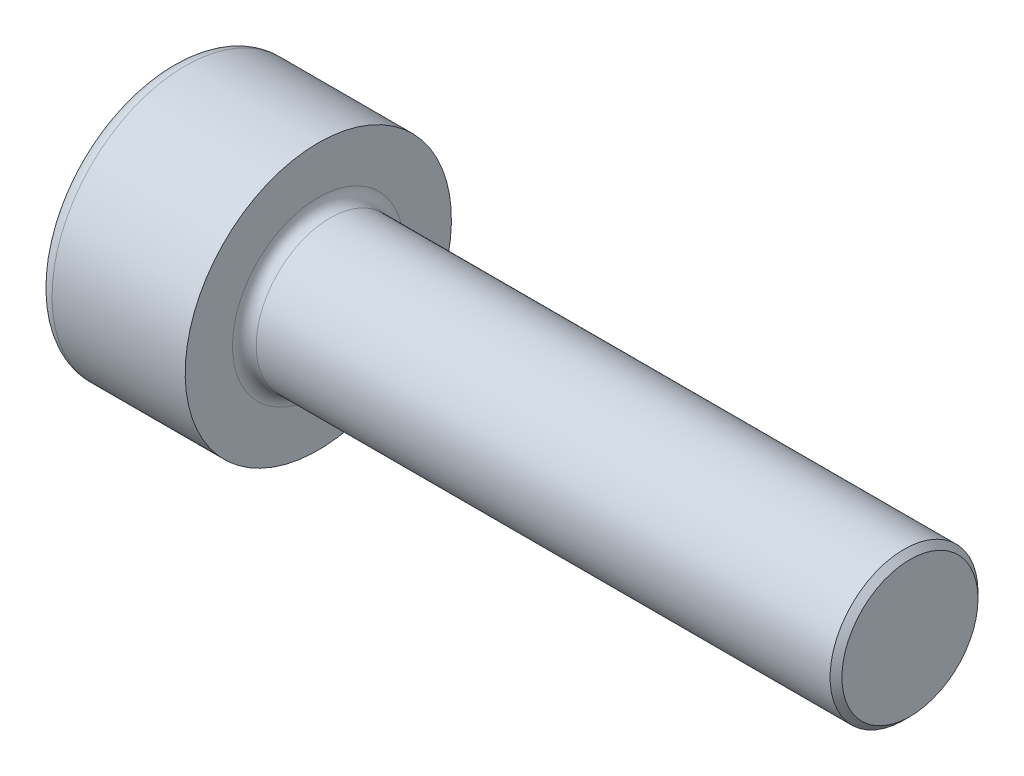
SolidWorks part; units mm, degrees
ref_plane "Front Plane" through (0, 0, 0) normal (0, 0, 1) x (1, 0, 0)
ref_plane "Top Plane" through (0, 0, 0) normal (0, 1, 0) x (1, 0, 0)
ref_plane "Right Plane" through (0, 0, 0) normal (1, 0, 0) x (0, 0, -1)
imported_body "Imported1"
sketch "Sketch1" plane through (0, 0, 0) normal (1, 0, 0) x (0, 0, -1)
  circle A0 centre (0, 0) radius 3.9205
extrude "Extrude1" cut sketch "Sketch1" along normal through all
sketch "Sketch2" plane through (0, 0, 0) normal (1, 0, 0) x (0, 0, -1)
  circle A0 centre (0, 0) radius 1.25
  dimension "D1" = 2.5
extrude "Extrude2" add sketch "Sketch2" along normal blind 10
fillet "Fillet1" radius 0.2 1 edges at (0, 0, -1.25)
chamfer "Chamfer1" distance 0.1 angle 45 1 edges at (10, 0, -1.25)
